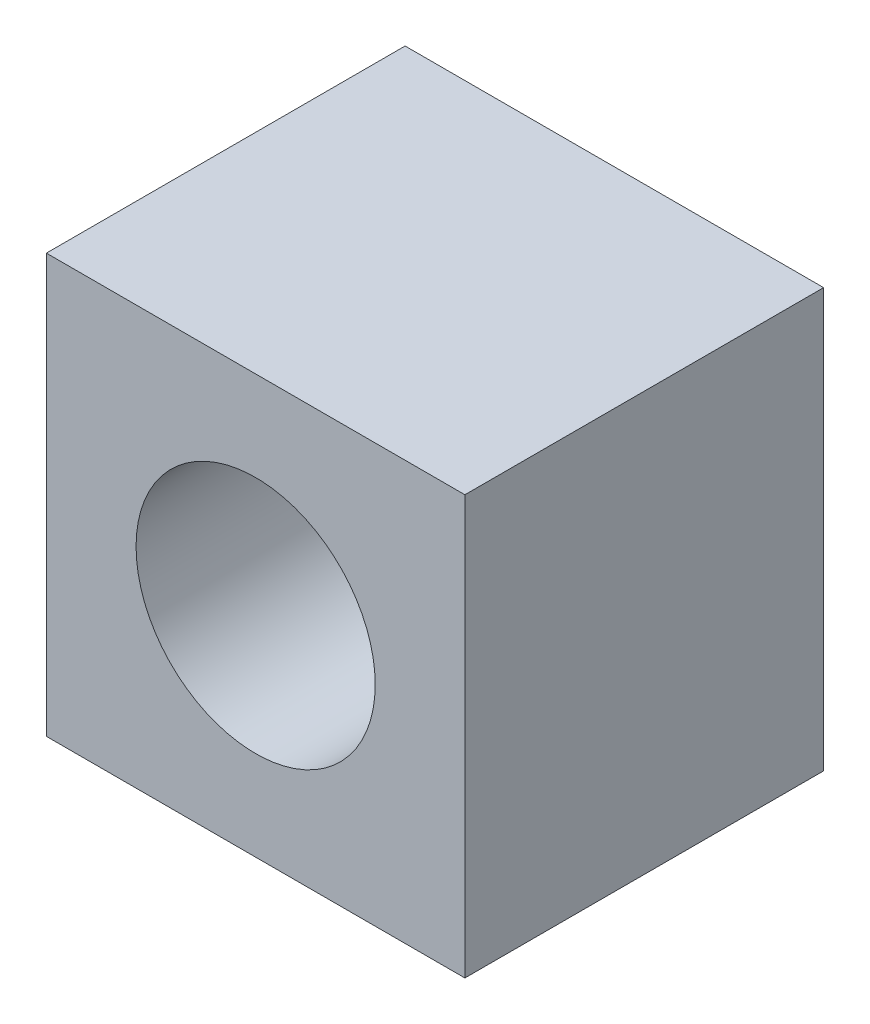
SolidWorks part; units mm, degrees
ref_plane "Front Plane" through (0, 0, 0) normal (1, 0, 0) x (0, 1, 0)
ref_plane "Top Plane" through (0, 0, 0) normal (0, 0, 1) x (0, 1, 0)
ref_plane "Right Plane" through (0, 0, 0) normal (0, 1, 0) x (-1, 0, 0)
sketch "Sketch1" plane through (0, 0, 0) normal (0, 0, 1) x (0, 1, 0)
  line L1 (-11.1125, 11.1125) -> (11.1125, 11.1125)
  line L2 (-11.1125, 11.1125) -> (-11.1125, -11.1125)
  line L3 (-11.1125, -11.1125) -> (11.1125, -11.1125)
  line L4 (11.1125, 11.1125) -> (11.1125, -11.1125)
  line L5 (-11.1125, 11.1125) -> (11.1125, -11.1125) construction
  line L6 (-11.1125, -11.1125) -> (11.1125, 11.1125) construction
  circle A0 centre (0, 0) radius 6.35
  point P0 (0, 0)
  dimension "D1" = 12.7
  dimension "D2" = 22.225
  dimension "D3" = 22.225
extrude "Boss-Extrude1" add sketch "Sketch1" along normal blind 19.05
